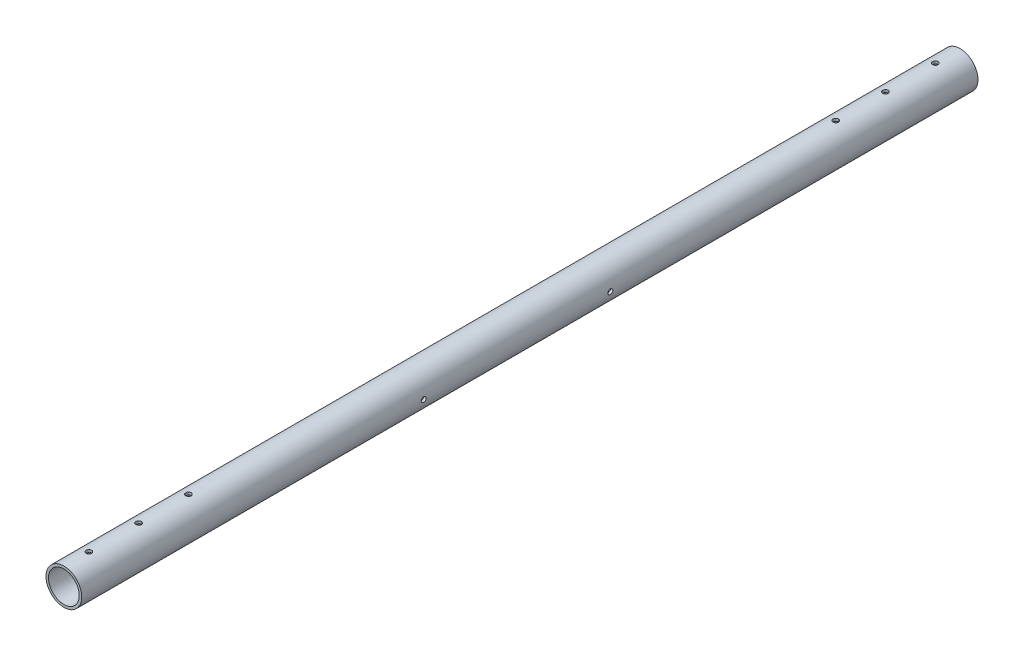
SolidWorks part; units mm, degrees
ref_plane "Front Plane" through (0, 0, 0) normal (0, 0, 1) x (1, 0, 0)
ref_plane "Top Plane" through (0, 0, 0) normal (0, 1, 0) x (1, 0, 0)
ref_plane "Right Plane" through (0, 0, 0) normal (1, 0, 0) x (0, 0, -1)
sketch "Sketch1" plane through (0, 0, 0) normal (0, 0, 1) x (1, 0, 0)
  circle A0 centre (0, 0) radius 36.5125
  circle A1 centre (0, 0) radius 31.369
  dimension "D1" = 73.025
  dimension "D2" = 62.738
extrude "Extrude1" add sketch "Sketch1" along normal mid plane 1828.8
ref_plane "Plane1" through (0, 36.576, 0) normal (0, 1, 0) x (-1, 0, 0)
sketch "Sketch2" plane through (0, 36.576, 0) normal (0, 1, 0) x (-1, 0, 0)
  line L0 (36.5125, 914.4) -> (-36.5125, 914.4) construction
  circle A0 centre (0, 863.6) radius 5.588
  dimension "D2" = 11.176
  dimension "D1" = 50.8
extrude "Cut-Extrude1" cut sketch "Sketch2" against normal through all
pattern_linear "LPattern1" count 3 spacing 101.6 along (0, 0, -1) of "Cut-Extrude1"
mirror "Mirror1" about plane through (0, 0, 0) normal (0, 0, 1) of "LPattern1", "Cut-Extrude1"
ref_plane "Plane2" through (36.576, 0, 0) normal (1, 0, 0) x (0, 0, -1)
sketch "Sketch3" plane through (36.576, 0, 0) normal (1, 0, 0) x (0, 0, -1)
  line L0 (-914.4, 36.5125) -> (-914.4, -36.5125) construction
  circle A0 centre (-216.662, 0) radius 5.08
  circle A1 centre (164.338, 0) radius 5.08
  dimension "D1" = 10.16
  dimension "D2" = 381
  dimension "D3" = 697.738
extrude "Cut-Extrude2" cut sketch "Sketch3" against normal through all
